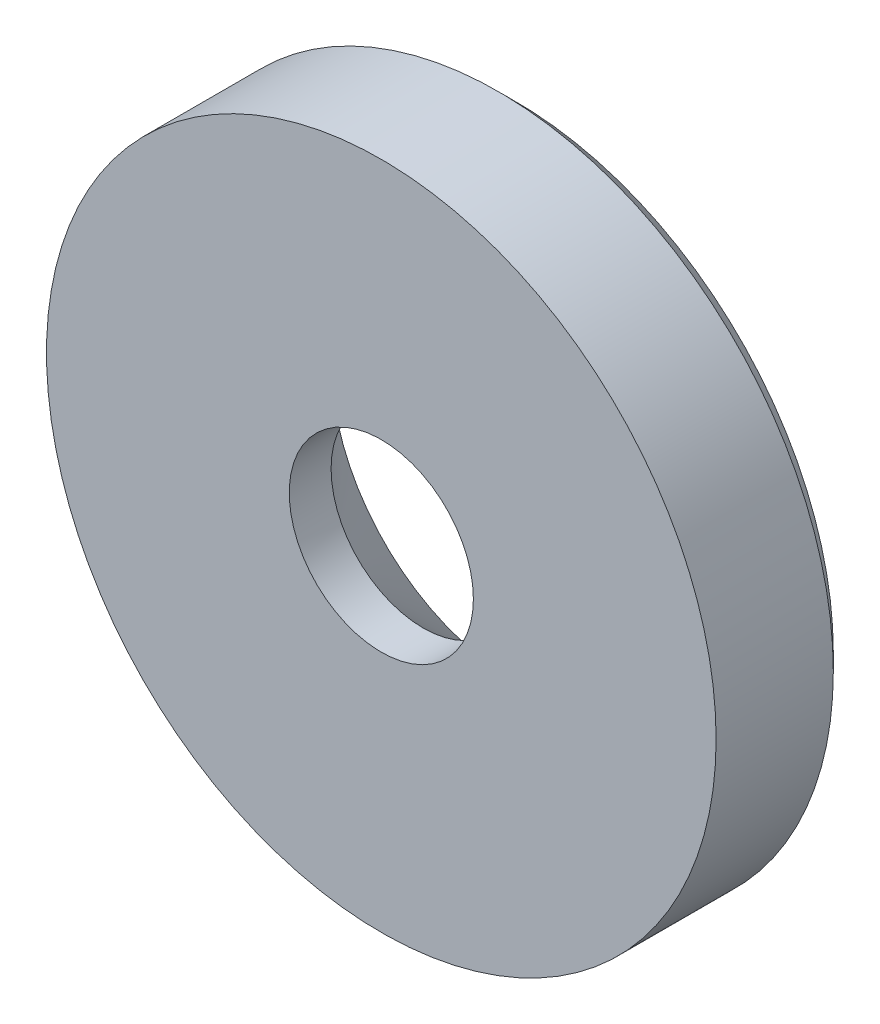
SolidWorks part; units mm, degrees
ref_plane "Front" through (0, 0, 0) normal (0, 0, 1) x (1, 0, 0)
ref_plane "Top" through (0, 0, 0) normal (0, 1, 0) x (1, 0, 0)
ref_plane "Right" through (0, 0, 0) normal (1, 0, 0) x (0, 0, -1)
sketch "Sketch1" plane through (0, 0, 0) normal (0, 0, 1) x (1, 0, 0)
  circle A0 centre (0, 0) radius 10
  circle A1 centre (0, 0) radius 2.75
  dimension "D0" = 20
  dimension "d" = 5.5
extrude "Base-Extrude" add sketch "Sketch1" against normal blind 4
sketch "Sketch2" plane through (0, 0, 0) normal (0, 1, 0) x (1, 0, 0)
  line L0 (-5.5, 4) -> (-2.75, 4)
  line L2 (-2.75, 4) -> (-2.75, 1.25)
  line L3 (-2.75, 1.25) -> (-5.5, 4)
  line L5 (0, 8.4656) -> (0, -7.9977) construction
  line L6 (-2.75, 4) -> (-2.75, 0) construction
  line L7 (10, 4) -> (-10, 4) construction
  dimension "D1" = 11
  dimension "a" = 45
revolve "Cut-Revolve1" cut sketch "Sketch2" angle 360 about L5
chamfer "Chamfer1" distance 0.5 angle 45 1 edges at (10, 0, -4)
sketch "Sketch3" plane through (-5.3213, -16.4716, -4) normal (0, 0, -1) x (-1, 0, 0)
  circle A0 centre (-5.3213, 10.4716) radius 1.05
  dimension "d1" = 2.1
  dimension "L" = 6
extrude "Hole-Exscind" [suppressed] cut sketch "Sketch3" against normal through all
